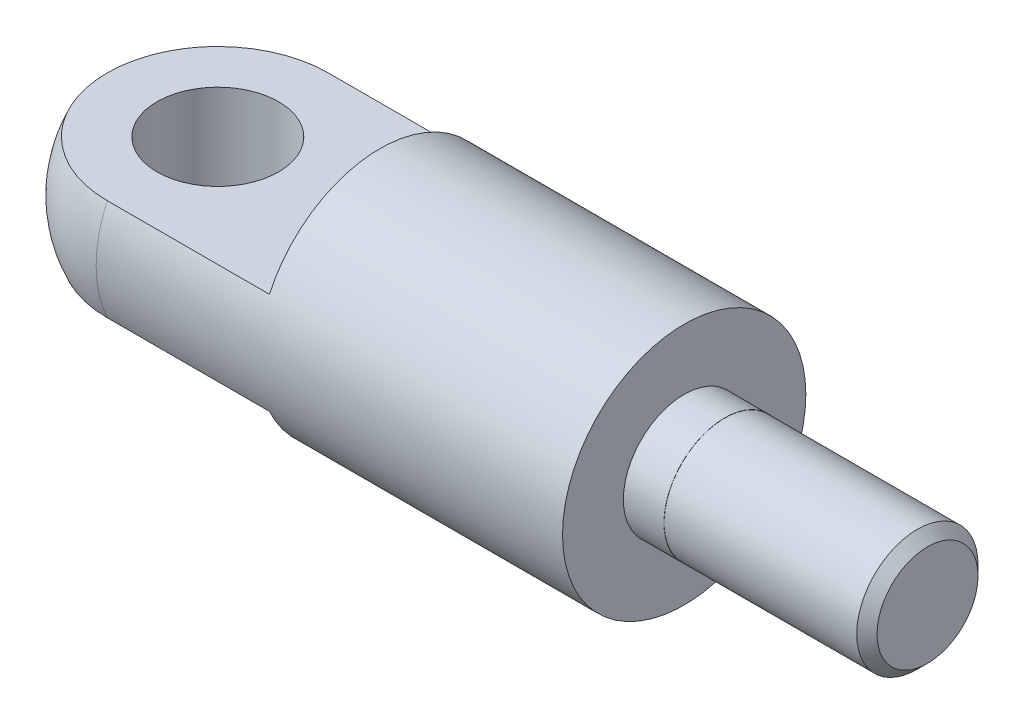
SolidWorks part; units mm, degrees
ref_plane "Front" through (0, 0, 0) normal (0, 0, 1) x (1, 0, 0)
ref_plane "Top" through (0, 0, 0) normal (0, 1, 0) x (1, 0, 0)
ref_plane "Right" through (0, 0, 0) normal (1, 0, 0) x (0, 0, -1)
sketch "Sketch1" plane through (0, 0, 0) normal (0, 1, 0) x (1, 0, 0)
  line L0 (0, 0) -> (41, 0)
  line L1 (41, 0) -> (41, 3)
  line L2 (41, 3) -> (29, 3)
  line L3 (29, 3) -> (29, 6)
  line L4 (29, 6) -> (6, 6)
  arc A0 (6, 6) -> (0, 0) centre (6, 0) ccw
revolve "Revolve1" add sketch "Sketch1" angle 360 about L0
sketch "Sketch2" plane through (0, 0, 0) normal (0, 0, 1) x (1, 0, 0)
  line L2 (0, -2.5) -> (14, -2.5)
  line L3 (0, 2.5) -> (14, 2.5)
  line L4 (0, 2.5) -> (0, 9.4234)
  line L5 (0, -2.5) -> (0, -8.6568)
  line L7 (14, -2.5) -> (14, -8.6568)
  line L8 (14, 2.5) -> (14, 9.4234)
  line L10 (14, 9.4234) -> (0, 9.4234)
  line L11 (0, -8.6568) -> (14, -8.6568)
extrude "Cut-Extrude1" cut sketch "Sketch2" against normal mid plane 20
sketch "Sketch3" plane through (0, 2.5, 0) normal (0, 1, 0) x (-1, 0, 0)
  circle A0 centre (-6, 0) radius 3
extrude "Cut-Extrude2" cut sketch "Sketch3" against normal blind 20
sketch "Sketch5" plane through (41, 0, 0) normal (1, 0, 0) x (0, 0, -1)
  circle A0 centre (0, 0) radius 2.99
  circle A1 centre (0, 0) radius 5.4334
  dimension "D1" = 5.98
  dimension "D2" = 10.8669
extrude "Cut-Extrude4" cut sketch "Sketch5" against normal blind 10
chamfer "Chamfer1" distance 0.5 angle 45 1 edges at (41, 0, -2.99)
